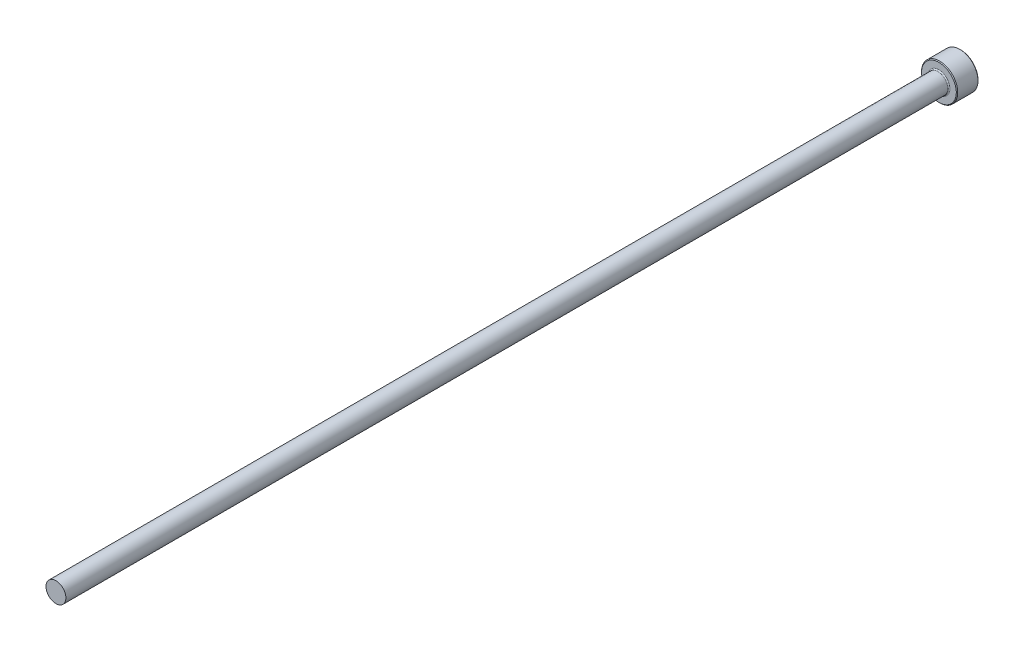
SolidWorks part; units mm, degrees
ref_plane "Front Plane" through (0, 0, 0) normal (0, 0, 1) x (1, 0, 0)
ref_plane "Top Plane" through (0, 0, 0) normal (0, 1, 0) x (1, 0, 0)
ref_plane "Right Plane" through (0, 0, 0) normal (1, 0, 0) x (0, 0, -1)
sketch "Sketch1" plane through (0, 0, 0) normal (1, 0, 0) x (0, 0, -1)
  line L0 (0, 0) -> (0, 5)
  line L1 (0, 5.5) -> (0, -5.5) construction
  line L2 (0, 5) -> (-6, 5)
  line L3 (-6, 5) -> (-6, 3.05)
  line L4 (-6.3, 2.75) -> (-250, 2.75)
  line L5 (-250, 2.75) -> (-250, 0)
  line L6 (5.5, 0) -> (-5.5, 0) construction
  line L7 (-250, 0) -> (0, 0)
  line L8 (-109.0506, 0) -> (16.9928, 0) construction
  arc A0 (-6, 3.05) -> (-6.3, 2.75) centre (-6.3, 3.05) cw
  dimension "D1" = 0.3
  dimension "D2" = 10
  dimension "D3" = 5.5
  dimension "D4" = 250
  dimension "D5" = 6
revolve "Revolve1" add sketch "Sketch1" angle 360 about L8
chamfer "Chamfer1" distance 0.2 angle 45 2 edges at (5, 0, 0) (5, 0, 6)
